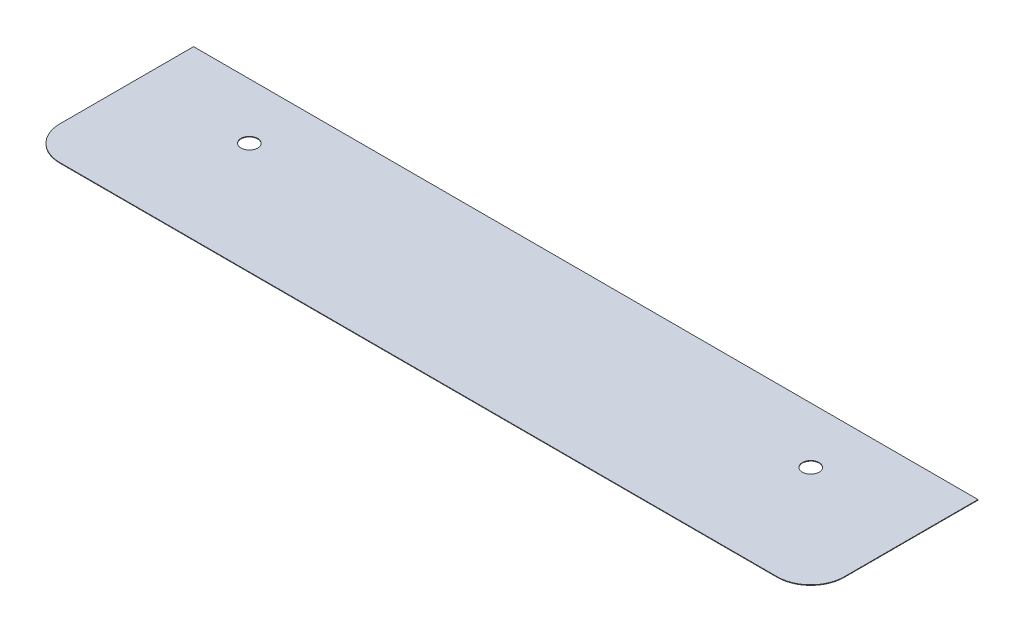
SolidWorks part; units mm, degrees
ref_plane "Front Plane" through (0, 0, 0) normal (0, 0, 1) x (1, 0, 0)
ref_plane "Top Plane" through (0, 0, 0) normal (0, 1, 0) x (1, 0, 0)
ref_plane "Right Plane" through (0, 0, 0) normal (1, 0, 0) x (0, 0, -1)
sketch "Sketch1" plane through (0, 0, 0) normal (0, 1, 0) x (1, 0, 0)
  line L1 (0, 0) -> (3573.78, 0)
  line L2 (0, 0) -> (0, 762)
  line L3 (0, 762) -> (3573.78, 762)
  line L4 (3573.78, 0) -> (3573.78, 762)
  dimension "D1" = 762
  dimension "D2" = 3573.78
extrude "Boss-Extrude1" add sketch "Sketch1" along normal blind 2.54
sketch "Sketch2" plane through (0, 2.54, 0) normal (0, 1, 0) x (1, 0, 0)
  line L0 (0, 762) -> (0, 0) construction
  line L1 (0, 0) -> (3573.78, 0) construction
  line L2 (0, 152.4) -> (0, 0)
  line L3 (0, 0) -> (152.4, 0)
  line L4 (1786.89, 0) -> (1786.89, -217.5305) construction
  line L5 (3573.78, 0) -> (3421.38, 0)
  line L6 (3573.78, 152.4) -> (3573.78, 0)
  arc A0 (0, 152.4) -> (152.4, 0) centre (152.4, 152.4) ccw
  arc A1 (3573.78, 152.4) -> (3421.38, 0) centre (3421.38, 152.4) cw
  dimension "D2" = 152.4
  dimension "D3" = 152.4
extrude "Cut-Extrude1" cut sketch "Sketch2" against normal blind 2.54
sketch "Sketch3" plane through (0, 2.54, 0) normal (0, 1, 0) x (1, 0, 0)
  line L0 (3573.78, 762) -> (0, 762) construction
  line L1 (0, 762) -> (0, 152.4) construction
  line L2 (1786.89, 762) -> (1786.89, 351.9103) construction
  circle A0 centre (508, 508) radius 38.1
  circle A1 centre (3065.78, 508) radius 38.1
  dimension "D3" = 76.2
  dimension "D1" = 254
  dimension "D2" = 508
extrude "Cut-Extrude2" cut sketch "Sketch3" against normal blind 2.54
